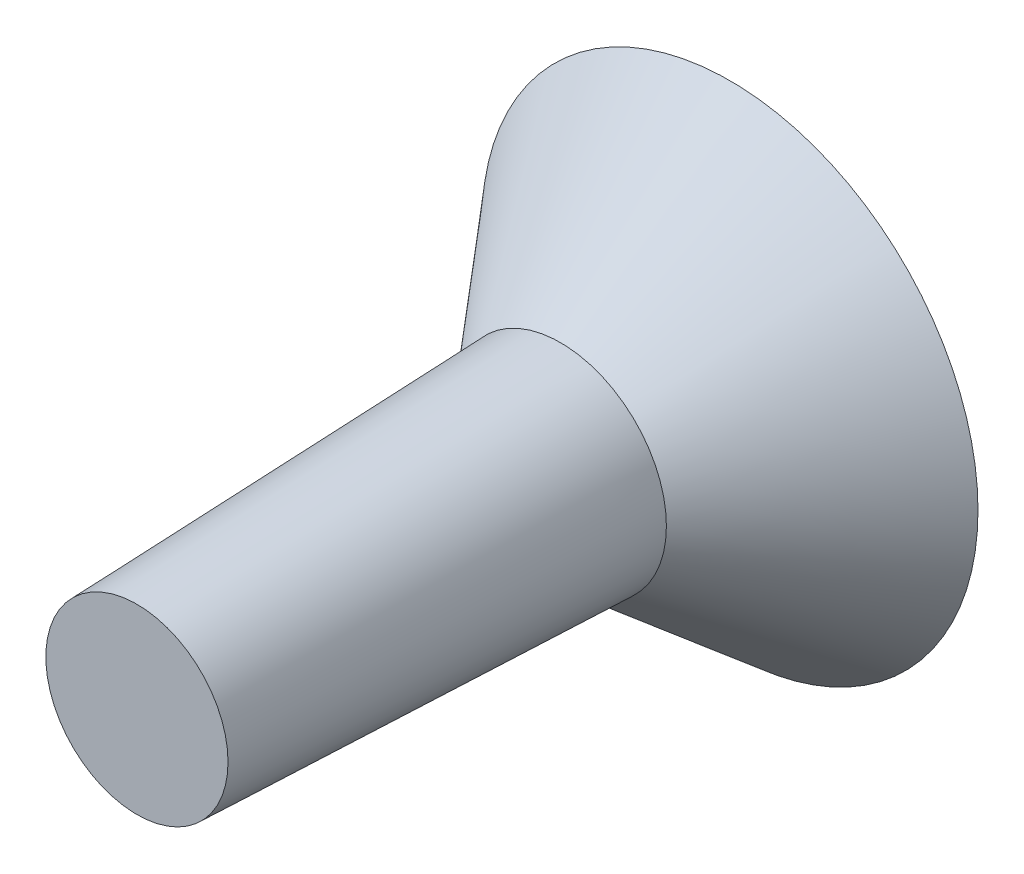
SolidWorks part; units mm, degrees
ref_plane "Plane1" through (0, 0, 0) normal (0, 0, 1) x (1, 0, 0)
ref_plane "Plane2" through (0, 0, 0) normal (0, 1, 0) x (1, 0, 0)
ref_plane "Plane3" through (0, 0, 0) normal (1, 0, 0) x (0, 0, -1)
sketch "Sketch1" plane through (0, 0, 0) normal (0, 0, 1) x (1, 0, 0)
  circle A0 centre (0, 0) radius 1.25
  dimension "D1" = 2.5
extrude "Base-Extrude" add sketch "Sketch1" along normal blind 5 draft 2
sketch "Sketch3" plane through (0, 0, 0) normal (0, 0, -1) x (-1, 0, 0)
  circle A1 centre (0, 0) radius 1.25
  circle A2 centre (0, 0) radius 1.25
  dimension "D1" = 0
extrude "Boss-Extrude2" add sketch "Sketch3" along normal blind 2 draft 40
sketch "Sketch4" plane through (0, 0, -2) normal (0, 0, -1) x (-1, 0, 0)
  line L0 (-0.375, 1.375) -> (-0.375, 0.375)
  line L1 (-0.375, 1.375) -> (0.375, 1.375)
  line L2 (0.375, 1.375) -> (0.375, 0.375)
  line L3 (0.375, 0.375) -> (1.375, 0.375)
  line L4 (1.375, 0.375) -> (1.375, -0.375)
  line L5 (1.375, -0.375) -> (0.375, -0.375)
  line L6 (0.375, -0.375) -> (0.375, -1.375)
  line L7 (0.375, -1.375) -> (-0.375, -1.375)
  line L8 (-0.375, -1.375) -> (-0.375, -0.375)
  line L9 (-0.375, -0.375) -> (-1.375, -0.375)
  line L10 (-1.375, -0.375) -> (-1.375, 0.375)
  line L11 (-1.375, 0.375) -> (-0.375, 0.375)
  line L12 (0, 1.375) -> (0, -1.375) construction
  line L13 (-1.375, 0) -> (1.375, 0) construction
  dimension "D1" = 1
  dimension "D2" = 0.75
extrude "Cut-Extrude1" cut sketch "Sketch4" against normal blind 1.3
draft "Dépouille1" type of draft neutral plane draft angle 45 faces to draft 4 parameters "D1"=45
